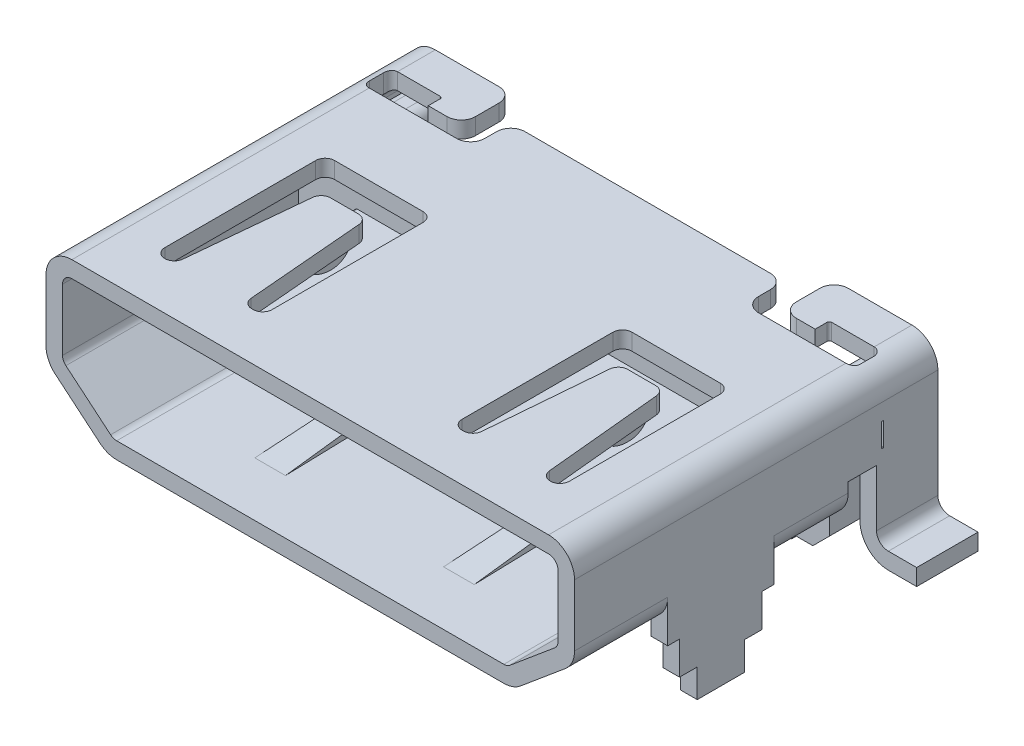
SolidWorks part; units mm, degrees
ref_plane "Front Plane" through (0, 0, 0) normal (0, 0, 1) x (1, 0, 0)
ref_plane "Top Plane" through (0, 0, 0) normal (0, 1, 0) x (1, 0, 0)
ref_plane "Right Plane" through (0, 0, 0) normal (1, 0, 0) x (0, 0, -1)
imported_body "Imported1"
sketch "Sketch1" plane through (0, 1.6, 0) normal (0, 1, 0) x (1, 0, 0)
  line L0 (0, 0) -> (0, 9.2252) construction
  line L1 (-3.8842, 1.185) -> (-3.6423, 3.6934)
  line L2 (-4.0872, 4.6027) -> (-2.2128, 4.6027)
  line L3 (-4.2872, 4.4027) -> (-4.2872, 1.2042)
  line L4 (-4.0872, 1.0042) -> (-4.0833, 1.0042)
  line L5 (-2.0128, 4.4027) -> (-2.0128, 1.2042)
  line L6 (-3.4432, 3.8742) -> (-2.8539, 3.8742)
  line L7 (-2.6547, 3.691) -> (-2.4435, 1.1874)
  line L8 (-3.15, 0.9852) -> (-3.15, 5.1515) construction
  line L9 (-2.2442, 1.0042) -> (-2.2128, 1.0042)
  arc A0 (-3.6423, 3.6934) -> (-3.4432, 3.8742) centre (-3.4432, 3.6742) cw
  arc A1 (-2.8539, 3.8742) -> (-2.6547, 3.691) centre (-2.8539, 3.6742) cw
  arc A2 (-2.2128, 1.0042) -> (-2.0128, 1.2042) centre (-2.2128, 1.2042) ccw
  arc A3 (-4.2872, 1.2042) -> (-4.0872, 1.0042) centre (-4.0872, 1.2042) ccw
  arc A4 (-4.0872, 4.6027) -> (-4.2872, 4.4027) centre (-4.0872, 4.4027) ccw
  arc A5 (-2.2128, 4.6027) -> (-2.0128, 4.4027) centre (-2.2128, 4.4027) cw
  arc A6 (-3.8842, 1.185) -> (-4.0833, 1.0042) centre (-4.0833, 1.2042) cw
  arc A7 (-2.4435, 1.1874) -> (-2.2442, 1.0042) centre (-2.2442, 1.2042) ccw
  point P29 (-2.428, 1.0042)
  dimension "D2" = 0.2
  dimension "D3" = 0.2
  dimension "D4" = 0.2
  dimension "D1" = 3.15
extrude "Cut-Extrude1" cut sketch "Sketch1" against normal blind 1
mirror "Mirror1" about plane through (0, 0, 0) normal (1, 0, 0) of "Cut-Extrude1"
